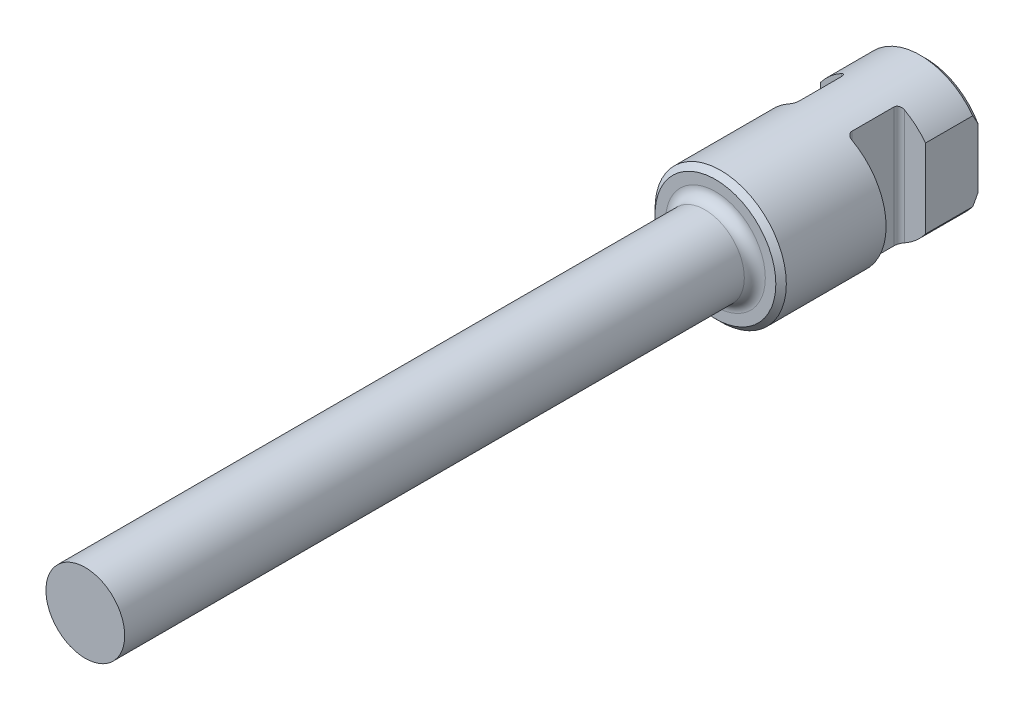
SolidWorks part; units mm, degrees
ref_plane "Plan de face" through (0, 0, 0) normal (0, 0, 1) x (1, 0, 0)
ref_plane "Plan de dessus" through (0, 0, 0) normal (0, 1, 0) x (1, 0, 0)
ref_plane "Plan de droite" through (0, 0, 0) normal (1, 0, 0) x (0, 0, -1)
sketch "Esquisse1" plane through (0, 0, 0) normal (0, 0, 1) x (1, 0, 0)
  circle A0 centre (0, 0) radius 2.5
  dimension "D1" = 5
extrude "Boss.-Extru.1" add sketch "Esquisse1" along normal blind 8
sketch "Esquisse2" plane through (0, 0, 8) normal (0, 0, 1) x (1, 0, 0)
  circle A0 centre (0, 0) radius 1.5
  dimension "D1" = 3
extrude "Boss.-Extru.2" add sketch "Esquisse2" along normal blind 24
fillet "Congé1" radius 0.4 1 edges at (1.5, 0, 8)
chamfer "Chanfrein1" distance 0.2 angle 45 1 edges at (2.5, 0, 0)
sketch "Esquisse3" plane through (0, 0, 0) normal (0, 0, -1) x (-1, 0, 0)
  line L0 (0, 0) -> (0, 2.5) construction
  line L1 (-4, 3) -> (-2, 3)
  line L2 (-4, 3) -> (-4, -3)
  line L3 (-4, -3) -> (-2, -3)
  line L4 (-2, 3) -> (-2, -3)
  line L5 (0, 0) -> (-2.5, 0) construction
  line L6 (2, 3) -> (2, -3)
  line L7 (4, -3) -> (2, -3)
  line L8 (4, 3) -> (4, -3)
  line L9 (4, 3) -> (2, 3)
  circle A0 centre (0, 0) radius 2.5 construction
  dimension "D1" = 2
  dimension "D2" = 6
  dimension "D3" = 2
extrude "Enlèv. mat.-Extru.1" cut sketch "Esquisse3" against normal blind 4
sketch "Esquisse4" plane through (0, 0, 4) normal (0, 0, -1) x (-1, 0, 0)
  line L0 (0, 0) -> (0, 1.5378) construction
  line L1 (-3, 3) -> (-1, 3)
  line L2 (-3, 3) -> (-3, -3)
  line L3 (-3, -3) -> (-1, -3)
  line L4 (-1, 3) -> (-1, -3)
  line L5 (0, 0) -> (-2, 0) construction
  line L6 (-2, -1.1358) -> (-2, 1.1358) construction
  line L7 (1, 3) -> (1, -3)
  line L8 (3, -3) -> (1, -3)
  line L9 (3, 3) -> (3, -3)
  line L10 (3, 3) -> (1, 3)
  dimension "D1" = 2
  dimension "D2" = 6
  dimension "D3" = 2
extrude "Enlèv. mat.-Extru.2" cut sketch "Esquisse4" along normal offset from surface (2 mm away) 2
fillet "Congé2" radius 0.2 4 edges at (-1, 0, 2) (-1, 0, 4) (1, 0, 2) (1, 0, 4)
chamfer "Chanfrein2" distance 0.2 angle 45 1 edges at (2.5, 0, 8)
